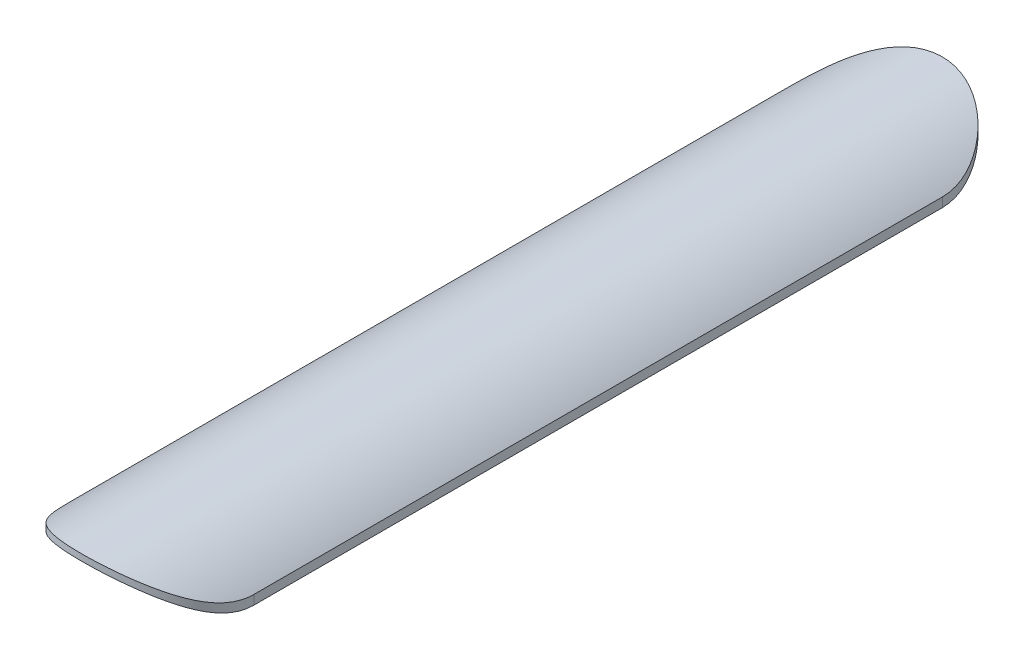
SolidWorks part; units mm, degrees
ref_plane "Plan de face" through (0, 0, 0) normal (0, 0, 1) x (1, 0, 0)
ref_plane "Plan de dessus" through (0, 0, 0) normal (0, 1, 0) x (1, 0, 0)
ref_plane "Plan de droite" through (0, 0, 0) normal (1, 0, 0) x (0, 0, -1)
sketch "Esquisse1" plane through (0, 0, 0) normal (0, 0, 1) x (1, 0, 0)
  arc A0 (-57, 0) -> (57, 0) centre (0, 0) cw
  dimension "D1" = 57
extrude "Extru.-Mince1" add sketch "Esquisse1" along normal mid plane 420 thin
sketch "Esquisse2" plane through (0, 0, 0) normal (0, 1, 0) x (1, 0, 0)
  line L0 (0, 160) -> (0, -160) construction
  line L1 (40, 160) -> (40, -160)
  line L2 (-40, 160) -> (-40, -160)
  arc A0 (40, 160) -> (-40, 160) centre (0, 160) ccw
  arc A1 (-40, -160) -> (40, -160) centre (0, -160) ccw
  point P2 (0, 0)
  dimension "D2" = 40
  dimension "D1" = 320
split "Fractionner1" trim tools "Esquisse2" bodies to split 101 resulting bodies 102
